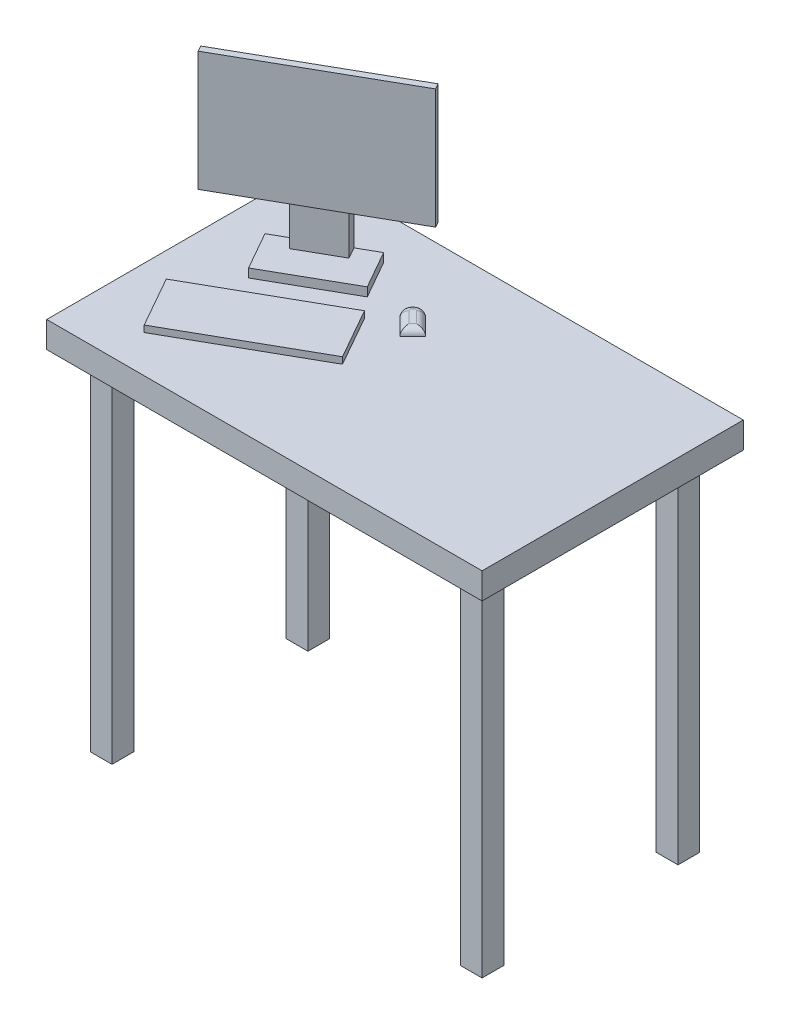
SolidWorks part; units mm, degrees
ref_plane "Plan de face" through (0, 0, 0) normal (0, 0, 1) x (1, 0, 0)
ref_plane "Plan de dessus" through (0, 0, 0) normal (0, 1, 0) x (1, 0, 0)
ref_plane "Plan de droite" through (0, 0, 0) normal (1, 0, 0) x (0, 0, -1)
sketch "Esquisse1" plane through (0, 0, 0) normal (0, 1, 0) x (1, 0, 0)
  line L1 (500, -300) -> (-500, -300)
  line L2 (500, -300) -> (500, 300)
  line L3 (500, 300) -> (-500, 300)
  line L4 (-500, -300) -> (-500, 300)
  line L5 (500, -300) -> (-500, 300) construction
  line L6 (500, 300) -> (-500, -300) construction
  point P0 (0, 0)
  dimension "D1" = 600
  dimension "D2" = 1000
extrude "Boss.-Extru.1" add sketch "Esquisse1" along normal blind 60
sketch "Esquisse2" plane through (0, 0, 0) normal (0, -1, 0) x (1, 0, 0)
  line L0 (-500, 300) -> (500, 300) construction
  line L1 (-450, 250) -> (-400, 250)
  line L2 (-450, 250) -> (-450, 200)
  line L3 (-450, 200) -> (-400, 200)
  line L4 (-400, 250) -> (-400, 200)
  line L5 (-450, 250) -> (-400, 200) construction
  line L6 (-450, 200) -> (-400, 250) construction
  line L7 (-500, -300) -> (-500, 300) construction
  point P0 (-425, 225)
  dimension "D1" = 50
  dimension "D2" = 50
  dimension "D3" = 50
  dimension "D4" = 50
extrude "Boss.-Extru.2" add sketch "Esquisse2" along normal blind 800
mirror "Symétrie1" about plane through (0, 0, 0) normal (1, 0, 0) of "Boss.-Extru.2"
mirror "Symétrie2" about plane through (0, 0, 0) normal (0, 0, 1) of "Symétrie1", "Boss.-Extru.2"
sketch "Esquisse3" plane through (0, 60, 0) normal (0, 1, 0) x (1, 0, 0)
  line L0 (-350.6278, 14.2936) -> (-400, 101.2556)
  line L1 (-350.6278, 14.2936) -> (-176.7038, 113.038)
  line L2 (-400, 101.2556) -> (-226.076, 200)
  line L3 (-176.7038, 113.038) -> (-226.076, 200)
  line L4 (500, 300) -> (-500, 300) construction
  line L5 (-500, 300) -> (-500, -300) construction
  dimension "D1" = 200
  dimension "D2" = 100
  dimension "D3" = 100
  dimension "D4" = 100
extrude "Boss.-Extru.3" add sketch "Esquisse3" along normal blind 20
sketch "Esquisse4" plane through (0, 80, 0) normal (0, 1, 0) x (1, 0, 0)
  line L0 (-356.519, 125.9417) -> (-269.557, 175.3139)
  line L1 (-356.519, 125.9417) -> (-341.7074, 99.8531)
  line L2 (-269.557, 175.3139) -> (-254.7454, 149.2253)
  line L3 (-341.7074, 99.8531) -> (-254.7454, 149.2253)
  line L4 (-226.076, 200) -> (-400, 101.2556) construction
  line L5 (-400, 101.2556) -> (-350.6278, 14.2936) construction
  line L6 (-176.7038, 113.038) -> (-226.076, 200) construction
  dimension "D1" = 50
  dimension "D2" = 50
  dimension "D3" = 30
extrude "Boss.-Extru.4" add sketch "Esquisse4" along normal blind 200
sketch "Esquisse5" plane through (-126.167, 0, -222.225) normal (0.4937, 0, 0.8696) x (0.8696, 0, -0.4937)
  line L0 (-147.8558, 280) -> (-247.8558, 280) construction
  line L1 (-397.8558, 180) -> (2.1442, 180)
  line L2 (-397.8558, 180) -> (-397.8558, 455)
  line L3 (-397.8558, 455) -> (2.1442, 455)
  line L4 (2.1442, 180) -> (2.1442, 455)
  line L5 (-297.8558, 80) -> (-97.8558, 80) construction
  point P4 (-197.8558, 280)
  dimension "D1" = 400
  dimension "D2" = 200
  dimension "D3" = 275
  dimension "D4" = 100
extrude "Boss.-Extru.5" add sketch "Esquisse5" along normal blind 15
sketch "Esquisse6" plane through (0, 60, 0) normal (0, 1, 0) x (1, 0, 0)
  line L0 (-428.1232, -97.3079) -> (-137.3174, 67.3653)
  line L1 (-428.1232, -97.3079) -> (-361.9905, -214.0954)
  line L2 (-137.3174, 67.3653) -> (-71.1847, -49.4222)
  line L3 (-361.9905, -214.0954) -> (-71.1847, -49.4222)
extrude "Boss.-Extru.6" add sketch "Esquisse6" along normal blind 15
sketch "Esquisse7" plane through (0, 60, 0) normal (0, 1, 0) x (1, 0, 0)
  line L0 (-111.1523, 122.2136) -> (-81.3996, 151.9663)
  line L1 (-111.1523, 122.2136) -> (-60.5107, 71.572)
  line L2 (-81.3996, 151.9663) -> (-30.758, 101.3248)
  line L3 (-60.5107, 71.572) -> (-30.758, 101.3248)
extrude "Boss.-Extru.7" add sketch "Esquisse7" along normal blind 15
fillet "Congé1" radius 20 2 edges at (-81.3996, 67.5, -151.9663) (-111.1523, 67.5, -122.2136)
fillet "Congé2" radius 15 6 edges at (-45.6344, 75, -86.4484) (-78.7605, 75, -89.8217) (-102.8681, 75, -122.2136) (-96.276, 75, -137.09) (-81.3996, 75, -143.6821) (-49.0077, 75, -119.5745)
